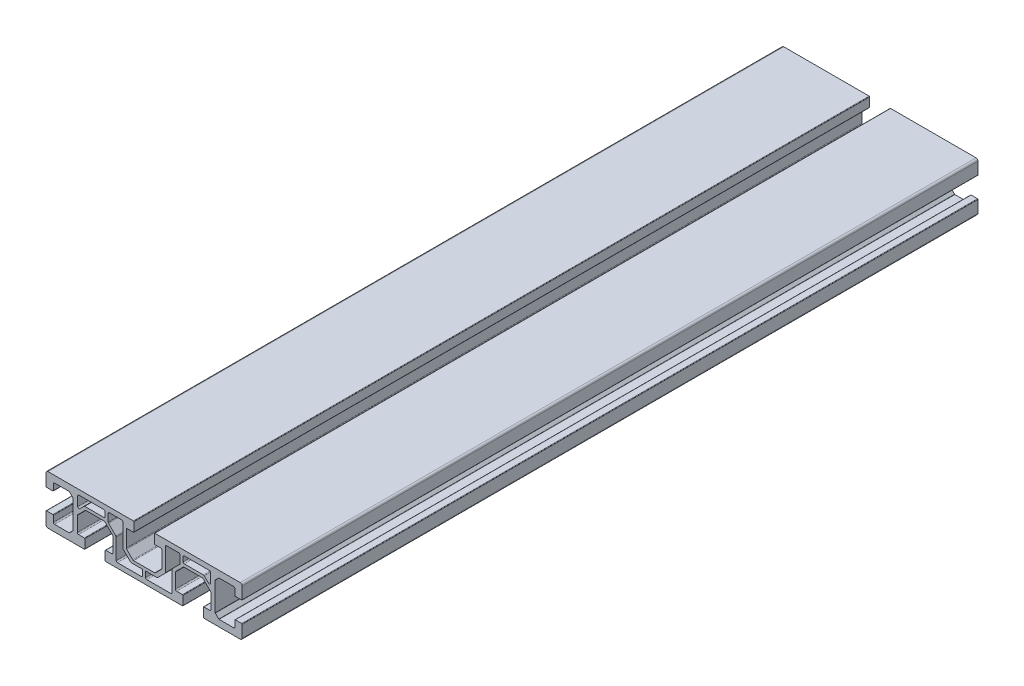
SolidWorks part; units mm, degrees
ref_plane "前视基准面" through (0, 0, 0) normal (0, 0, 1) x (1, 0, 0)
ref_plane "上视基准面" through (0, 0, 0) normal (0, 1, 0) x (1, 0, 0)
ref_plane "右视基准面" through (0, 0, 0) normal (1, 0, 0) x (0, 0, -1)
sketch "草图1"
sketch_block_instance "A$C3A3F3FF6-1"
sketch_block "A$C3A3F3FF6"
extrude "凸台-拉伸1" add sketch "草图1" along normal mid plane 300
